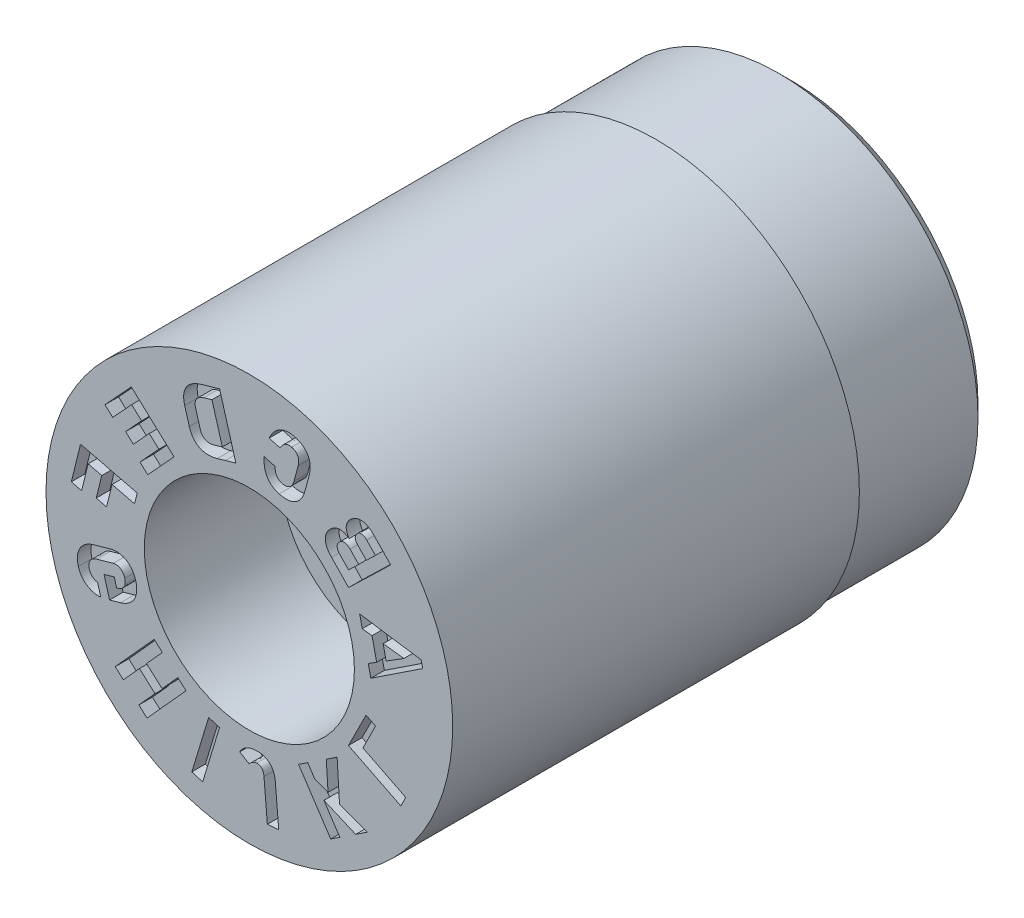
SolidWorks part; units mm, degrees
ref_plane "Front Plane" through (0, 0, 0) normal (0, 0, 1) x (1, 0, 0)
ref_plane "Top Plane" through (0, 0, 0) normal (0, 1, 0) x (1, 0, 0)
ref_plane "Right Plane" through (0, 0, 0) normal (1, 0, 0) x (0, 0, -1)
sketch "Sketch1" plane through (0, 0, 0) normal (1, 0, 0) x (0, 0, -1)
  line L2 (0, 3) -> (0, 1.55)
  line L3 (7.75, 3) -> (0, 3)
  line L4 (-3.7979, 0) -> (49996.2021, 0) construction
  line L8 (8, 0.8) -> (2, 0.8)
  line L9 (2, 1.55) -> (2, 0.8)
  line L10 (2, 1.55) -> (0, 1.55)
  line L12 (8, 0.8) -> (8, 2.75)
  line L16 (8, 2.75) -> (7.75, 3)
  dimension "D1" = 8
  dimension "D2" = 45
  dimension "D3" = 0.25
  dimension "D4" = 6
  dimension "D5" = 3.1
  dimension "D6" = 2
  dimension "D7" = 1.6
revolve "Revolve1" add sketch "Sketch1" angle 360 about L4
sketch "Sketch4" plane through (0, 0, 0) normal (1, 0, 0) x (0, 0, -1)
  line L0 (0, 0) -> (50000, 0) construction
  line L1 (8, -2.75) -> (8, 2.75) construction
  line L2 (6, 3.935) -> (8, 3.935)
  line L3 (6, 3.935) -> (6, 2.935)
  line L4 (6, 2.935) -> (8, 2.935)
  line L5 (8, 3.935) -> (8, 2.935)
  line L6 (7.75, 3) -> (0, 3) construction
  line L9 (0, 55) -> (0, -55) construction
  dimension "D1" = 1
  dimension "D2" = 0.065
  dimension "D3" = 6
revolve "Cut-Revolve1" cut sketch "Sketch4" angle 360 about L0
sketch "Sketch6" plane through (0, 0, 0) normal (0, 0, 1) x (1, 0, 0)
  line L0 (2.5571, 0.5171) -> (2.5349, 0.6172)
  line L1 (2.5349, 0.6172) -> (1.6277, 0.7509)
  line L2 (1.6277, 0.7509) -> (1.6655, 0.5813)
  line L3 (1.6655, 0.5813) -> (1.8101, 0.5641)
  line L4 (2.2808, 0.5082) -> (2.018, 0.3449)
  line L5 (1.7544, 0.1812) -> (1.7922, 0.0116)
  line L6 (1.7922, 0.0116) -> (2.5571, 0.5171)
  line L7 (2.018, 0.3449) -> (1.9736, 0.5447)
  line L8 (1.9736, 0.5447) -> (2.2808, 0.5082)
  line L9 (1.8101, 0.5641) -> (1.8781, 0.258)
  line L10 (1.6135, 1.3764) -> (1.4641, 1.2319)
  line L11 (1.4641, 1.2319) -> (1.336, 1.3642)
  line L12 (1.3285, 1.5197) -> (1.3298, 1.521)
  line L13 (1.4854, 1.5087) -> (1.6135, 1.3764)
  line L14 (-1.4763, 1.5045) -> (-1.335, 1.3745)
  line L15 (1.7261, 1.4853) -> (1.598, 1.6176)
  line L16 (1.7313, 1.7465) -> (1.8594, 1.6142)
  line L17 (2.0851, 1.6061) -> (1.8404, 1.8591)
  line L18 (-2.0255, 0.579) -> (-1.6938, 0.4969)
  line L19 (1.1985, 1.6218) -> (1.1971, 1.6204)
  line L20 (1.2125, 1.2662) -> (1.4644, 1.0058)
  line L21 (-1.3921, -1.7775) -> (-1.6299, -2.0407)
  line L22 (-1.5163, -1.455) -> (-1.2831, -1.1969)
  line L23 (1.8594, 1.6142) -> (1.7261, 1.4853)
  line L24 (1.1609, -1.7625) -> (0.9637, -1.6875)
  line L25 (1.4644, 1.0058) -> (2.0851, 1.6061)
  line L26 (0.8211, 1.9192) -> (0.882, 2.1465)
  line L27 (0.2919, 2.3293) -> (0.4537, 2.2861)
  line L28 (0.7202, 2.1897) -> (0.6593, 1.9624)
  line L29 (0.3806, 2.0127) -> (0.2187, 2.0558)
  line L30 (-0.3989, 1.8704) -> (-0.5202, 1.8352)
  line L31 (-0.7225, 1.9303) -> (-0.7931, 2.1741)
  line L32 (-0.6729, 2.3629) -> (-0.5516, 2.3981)
  line L33 (0.9637, -1.6875) -> (0.8611, -1.5324)
  line L34 (-0.4389, 2.5936) -> (-0.7129, 2.5143)
  line L35 (-0.9535, 2.1228) -> (-0.8856, 1.888)
  line L36 (-0.4726, 1.6859) -> (-0.3553, 1.7199)
  line L37 (-1.8507, 1.8487) -> (-1.7416, 1.9673)
  line L38 (-0.1991, 1.7651) -> (-0.3553, 1.7199)
  line L39 (-0.5516, 2.3981) -> (-0.3989, 1.8704)
  line L41 (-0.1991, 1.7651) -> (-0.4389, 2.5936)
  line L43 (-1.7362, 1.7435) -> (-1.5905, 1.6095)
  line L45 (-1.1114, 1.3878) -> (-1.7416, 1.9673)
  line L46 (-1.335, 1.3745) -> (-1.6141, 1.0709)
  line L47 (-1.6141, 1.0709) -> (-1.4996, 0.9657)
  line L48 (-1.4996, 0.9657) -> (-1.1114, 1.3878)
  line L50 (-1.5905, 1.6095) -> (-1.8257, 1.3537)
  line L51 (-1.8257, 1.3537) -> (-1.7116, 1.2486)
  line L52 (-1.7116, 1.2486) -> (-1.4763, 1.5045)
  line L54 (-1.8507, 1.8487) -> (-2.1299, 1.5452)
  line L55 (-2.1299, 1.5452) -> (-2.0153, 1.44)
  line L56 (-2.0153, 1.44) -> (-1.7362, 1.7435)
  line L59 (-2.378, 0.6662) -> (-2.1774, 0.6165)
  line L60 (-1.6938, 0.4969) -> (-1.6549, 0.6545)
  line L61 (-1.6549, 0.6545) -> (-2.4907, 0.8612)
  line L62 (-2.1774, 0.6165) -> (-2.2585, 0.2881)
  line L63 (-2.2585, 0.2881) -> (-2.1066, 0.2506)
  line L64 (-2.1066, 0.2506) -> (-2.0255, 0.579)
  line L66 (-2.4907, 0.8612) -> (-2.6265, 0.3121)
  line L67 (-2.6265, 0.3121) -> (-2.4748, 0.2745)
  line L68 (-2.4748, 0.2745) -> (-2.378, 0.6662)
  line L70 (-2.0623, -0.916) -> (-1.9005, -0.8702)
  line L71 (-2.0539, -0.2588) -> (-2.2986, -0.3279)
  line L72 (-2.1919, -0.9454) -> (-2.2397, -0.7767)
  line L73 (-2.2528, -0.4898) -> (-2.0081, -0.4206)
  line L74 (-1.944, -0.7077) -> (-1.9577, -0.7116)
  line L75 (-1.9577, -0.7116) -> (-1.9931, -0.5862)
  line L76 (-1.9931, -0.5862) -> (-2.1436, -0.6288)
  line L77 (-2.1436, -0.6288) -> (-2.0623, -0.916)
  line L78 (-1.6299, -2.0407) -> (-1.5098, -2.1492)
  line L79 (-1.5098, -2.1492) -> (-0.9342, -1.512)
  line L80 (-0.9342, -1.512) -> (-1.0543, -1.4036)
  line L81 (-1.0543, -1.4036) -> (-1.2875, -1.6617)
  line L82 (-1.9788, -1.7256) -> (-1.8588, -1.8341)
  line L83 (-1.8588, -1.8341) -> (-1.6209, -1.5708)
  line L84 (-1.2831, -1.1969) -> (-1.4032, -1.0884)
  line L85 (-1.4032, -1.0884) -> (-1.9788, -1.7256)
  line L86 (-1.6209, -1.5708) -> (-1.3921, -1.7775)
  line L88 (-1.2875, -1.6617) -> (-1.5163, -1.455)
  line L90 (-0.4398, -1.7339) -> (-0.6, -1.6854)
  line L91 (-0.6, -1.6854) -> (-0.8487, -2.5053)
  line L92 (-0.8487, -2.5053) -> (-0.6885, -2.5538)
  line L93 (-0.6885, -2.5538) -> (-0.4398, -1.7339)
  line L94 (-0.1417, -1.8962) -> (-0.001, -1.9813)
  line L95 (0.216, -2.0321) -> (0.2656, -2.6181)
  line L96 (0.2656, -2.6181) -> (0.4335, -2.604)
  line L97 (0.4335, -2.604) -> (0.3838, -2.0173)
  line L98 (1.1004, -1.8942) -> (1.5689, -2.0946)
  line L99 (1.5689, -2.0946) -> (1.7389, -1.9821)
  line L100 (1.7389, -1.9821) -> (1.3302, -1.8268)
  line L102 (1.2002, -2.3386) -> (1.3353, -2.2492)
  line L103 (1.3353, -2.2492) -> (1.1004, -1.8942)
  line L104 (0.8611, -1.5324) -> (0.726, -1.6219)
  line L105 (0.726, -1.6219) -> (1.2002, -2.3386)
  line L107 (1.3302, -1.8268) -> (1.295, -1.2455)
  line L108 (1.295, -1.2455) -> (1.1347, -1.3514)
  line L109 (1.1347, -1.3514) -> (1.1609, -1.7625)
  line L110 (2.235, -1.3993) -> (2.308, -1.2537)
  line L111 (2.308, -1.2537) -> (1.6759, -0.9371)
  line L113 (1.4626, -1.0125) -> (2.235, -1.3993)
  line L114 (1.6759, -0.9371) -> (1.862, -0.5653)
  line L115 (1.862, -0.5653) -> (1.7218, -0.4952)
  line L116 (1.7218, -0.4952) -> (1.4626, -1.0125)
  line L118 (1.8781, 0.258) -> (1.7544, 0.1812)
  spline S0 degree 3 poles (1.336, 1.3642) (1.3244, 1.3762) (1.3095, 1.3954) (1.298, 1.4242) (1.2944, 1.4448) (1.2959, 1.4651) (1.3043, 1.4922) (1.3179, 1.5096) (1.3285, 1.5197) knots 0 0 0 0 0.283532 0.406676 0.523065 0.636271 0.749424 1 1 1 1
  spline S1 degree 3 poles (1.3298, 1.521) (1.3372, 1.5279) (1.3487, 1.5377) (1.3663, 1.5459) (1.3792, 1.5502) (1.3924, 1.5525) (1.4059, 1.5522) (1.4194, 1.5503) (1.433, 1.5458) (1.4465, 1.5395) (1.465, 1.5282) (1.4773, 1.5168) (1.4854, 1.5087) knots 0 0 0 0 0.172391 0.251587 0.32731 0.402967 0.477182 0.553868 0.634034 0.717812 0.806398 1 1 1 1
  spline S2 degree 3 poles (1.598, 1.6176) (1.5875, 1.6285) (1.5742, 1.646) (1.564, 1.6723) (1.5614, 1.6914) (1.5633, 1.7102) (1.572, 1.7353) (1.5846, 1.7516) (1.5947, 1.7612) knots 0 0 0 0 0.278253 0.39924 0.514829 0.629035 0.743645 1 1 1 1
  spline S3 degree 3 poles (1.5947, 1.7612) (1.6037, 1.7699) (1.6191, 1.7811) (1.6429, 1.7869) (1.6608, 1.7872) (1.6789, 1.783) (1.7044, 1.7718) (1.7207, 1.7571) (1.7313, 1.7465) knots 0 0 0 0 0.243287 0.354451 0.467149 0.58504 0.709821 1 1 1 1
  spline S4 degree 3 poles (1.8404, 1.8591) (1.8221, 1.8776) (1.794, 1.9033) (1.7521, 1.929) (1.7216, 1.9432) (1.691, 1.9529) (1.6605, 1.9578) (1.6302, 1.9575) (1.6001, 1.9527) (1.5707, 1.943) (1.5313, 1.9236) (1.5049, 1.9025) (1.4885, 1.8865) knots 0 0 0 0 0.194856 0.283382 0.366878 0.446237 0.52245 0.597295 0.672599 0.749381 0.828228 1 1 1 1
  spline S5 degree 3 poles (1.4885, 1.8865) (1.4768, 1.8756) (1.4618, 1.8574) (1.446, 1.8308) (1.4376, 1.8103) (1.4319, 1.7893) (1.4291, 1.7679) (1.4291, 1.746) (1.4318, 1.7238) (1.4377, 1.7014) (1.4494, 1.6708) (1.462, 1.6489) (1.4716, 1.6348) knots 0 0 0 0 0.172429 0.253446 0.3329 0.410642 0.487984 0.565627 0.646116 0.728967 0.815207 1 1 1 1
  spline S6 degree 3 poles (1.4716, 1.6348) (1.4574, 1.6459) (1.435, 1.6607) (1.4028, 1.6743) (1.379, 1.6812) (1.3552, 1.6848) (1.3315, 1.6853) (1.308, 1.6826) (1.2849, 1.6766) (1.2622, 1.6677) (1.232, 1.651) (1.2115, 1.6342) (1.1985, 1.6218) knots 0 0 0 0 0.180056 0.264447 0.345697 0.425066 0.50274 0.58012 0.65862 0.738835 0.821735 1 1 1 1
  spline S7 degree 3 poles (1.1971, 1.6204) (1.1804, 1.6045) (1.1584, 1.5784) (1.1373, 1.5395) (1.1266, 1.5101) (1.1209, 1.4801) (1.1196, 1.4496) (1.1234, 1.4188) (1.132, 1.3878) (1.1453, 1.3567) (1.1702, 1.3143) (1.1943, 1.2849) (1.2125, 1.2662) knots 0 0 0 0 0.172259 0.251868 0.328671 0.404017 0.478443 0.555079 0.634373 0.717906 0.8057 1 1 1 1
  spline S8 degree 3 poles (0.4389, 1.6905) (0.4542, 1.6866) (0.4768, 1.6814) (0.507, 1.6773) (0.5287, 1.6758) (0.5499, 1.6755) (0.5706, 1.6768) (0.5907, 1.6791) (0.6102, 1.6831) (0.6291, 1.6884) (0.6472, 1.695) (0.6648, 1.7027) (0.6816, 1.7118) (0.6975, 1.7224) (0.7129, 1.7341) (0.7274, 1.7471) (0.7414, 1.7614) (0.7543, 1.777) (0.7667, 1.7936) (0.7778, 1.8118) (0.7882, 1.8309) (0.7979, 1.8512) (0.8098, 1.8804) (0.817, 1.9034) (0.8211, 1.9192) knots 0 0 0 0 0.093041 0.137574 0.180288 0.221966 0.262948 0.302743 0.341969 0.380633 0.418693 0.456346 0.494092 0.531697 0.569549 0.608177 0.647455 0.687506 0.728242 0.770136 0.813404 0.857487 0.903244 1 1 1 1
  spline S9 degree 3 poles (0.882, 2.1465) (0.8861, 2.1623) (0.8915, 2.1857) (0.8956, 2.217) (0.8977, 2.2393) (0.8981, 2.2611) (0.8974, 2.2824) (0.8952, 2.303) (0.8916, 2.323) (0.8869, 2.3423) (0.8806, 2.3609) (0.8734, 2.3788) (0.8645, 2.3957) (0.8546, 2.4121) (0.8434, 2.4276) (0.8308, 2.4424) (0.8171, 2.4564) (0.8021, 2.4694) (0.786, 2.4818) (0.7687, 2.4932) (0.7503, 2.5036) (0.7306, 2.5131) (0.7024, 2.5246) (0.6803, 2.5318) (0.6651, 2.5358) knots 0 0 0 0 0.096646 0.142265 0.186537 0.229586 0.27125 0.312358 0.352139 0.391536 0.43001 0.468003 0.505818 0.54329 0.581231 0.619098 0.657881 0.697033 0.73716 0.777713 0.81958 0.862597 0.90693 1 1 1 1
  spline S10 degree 3 poles (0.6651, 2.5358) (0.6403, 2.5424) (0.6026, 2.5485) (0.5524, 2.5466) (0.5166, 2.5402) (0.4819, 2.5297) (0.4489, 2.514) (0.4174, 2.4941) (0.3879, 2.4694) (0.3601, 2.4407) (0.3255, 2.3951) (0.3041, 2.3567) (0.2919, 2.3293) knots 0 0 0 0 0.164609 0.2424 0.319897 0.396879 0.473938 0.552867 0.634604 0.719746 0.807993 1 1 1 1
  spline S11 degree 3 poles (0.4537, 2.2861) (0.4599, 2.2983) (0.4706, 2.3154) (0.4871, 2.3357) (0.5002, 2.3485) (0.5139, 2.3596) (0.5282, 2.3688) (0.5431, 2.3757) (0.5584, 2.3809) (0.5742, 2.384) (0.5961, 2.3854) (0.6125, 2.3825) (0.6233, 2.3799) knots 0 0 0 0 0.194869 0.28509 0.372239 0.45516 0.535867 0.61291 0.689489 0.76552 0.841164 1 1 1 1
  spline S12 degree 3 poles (0.6233, 2.3799) (0.637, 2.3763) (0.6564, 2.3689) (0.679, 2.3546) (0.6933, 2.3423) (0.7052, 2.3283) (0.7149, 2.3127) (0.7219, 2.2954) (0.7266, 2.2767) (0.7289, 2.2565) (0.7282, 2.2271) (0.7245, 2.2047) (0.7202, 2.1897) knots 0 0 0 0 0.174354 0.254683 0.331248 0.40648 0.4812 0.556972 0.636726 0.719434 0.807138 1 1 1 1
  spline S13 degree 3 poles (0.6593, 1.9624) (0.6555, 1.9473) (0.6475, 1.926) (0.6335, 1.9003) (0.6216, 1.8841) (0.6082, 1.8703) (0.5934, 1.8591) (0.5773, 1.8503) (0.56, 1.8441) (0.5416, 1.8406) (0.5148, 1.8398) (0.4943, 1.843) (0.4807, 1.8467) knots 0 0 0 0 0.193001 0.280018 0.363208 0.441814 0.518168 0.593026 0.66813 0.744727 0.825194 1 1 1 1
  spline S14 degree 3 poles (0.4807, 1.8467) (0.4698, 1.8496) (0.454, 1.8557) (0.4353, 1.8676) (0.4229, 1.878) (0.412, 1.89) (0.4025, 1.9034) (0.3947, 1.9184) (0.3884, 1.9348) (0.3839, 1.9526) (0.3796, 1.9786) (0.3797, 1.9989) (0.3806, 2.0127) knots 0 0 0 0 0.159979 0.236987 0.31261 0.389007 0.465623 0.544809 0.627756 0.713749 0.80432 1 1 1 1
  spline S15 degree 3 poles (0.2187, 2.0558) (0.2164, 2.026) (0.2152, 1.982) (0.2231, 1.9253) (0.2325, 1.8864) (0.2458, 1.8505) (0.2629, 1.8174) (0.2837, 1.7875) (0.3081, 1.7607) (0.3361, 1.7376) (0.3783, 1.7106) (0.4142, 1.6972) (0.4389, 1.6905) knots 0 0 0 0 0.191703 0.280772 0.365726 0.447317 0.525894 0.603227 0.68015 0.75723 0.835508 1 1 1 1
  spline S16 degree 3 poles (-0.5202, 1.8352) (-0.5323, 1.8314) (-0.5504, 1.8277) (-0.5743, 1.825) (-0.5909, 1.8244) (-0.6068, 1.8256) (-0.622, 1.828) (-0.6364, 1.832) (-0.6501, 1.8375) (-0.6628, 1.8444) (-0.6746, 1.8527) (-0.6852, 1.8624) (-0.6949, 1.8733) (-0.7034, 1.8856) (-0.7139, 1.9042) (-0.7192, 1.9197) (-0.7225, 1.9303) knots 0 0 0 0 0.149232 0.218368 0.283345 0.346009 0.406128 0.464759 0.522601 0.579442 0.635448 0.692041 0.748656 0.80738 0.868897 1 1 1 1
  spline S17 degree 3 poles (-0.7931, 2.1741) (-0.7963, 2.1848) (-0.7996, 2.2009) (-0.801, 2.2222) (-0.8003, 2.2373) (-0.7979, 2.2517) (-0.7941, 2.2656) (-0.7887, 2.279) (-0.7814, 2.2916) (-0.7728, 2.3035) (-0.7627, 2.3146) (-0.7514, 2.325) (-0.7385, 2.3344) (-0.7241, 2.3428) (-0.7025, 2.3533) (-0.685, 2.3595) (-0.6729, 2.3629) knots 0 0 0 0 0.131395 0.192752 0.251615 0.30871 0.365291 0.421108 0.478124 0.535945 0.594614 0.654753 0.716891 0.782368 0.850988 1 1 1 1
  spline S18 degree 3 poles (-0.7129, 2.5143) (-0.7296, 2.5095) (-0.7539, 2.5012) (-0.7849, 2.4884) (-0.8064, 2.4781) (-0.8267, 2.467) (-0.8457, 2.455) (-0.8633, 2.4421) (-0.8798, 2.4287) (-0.8949, 2.4143) (-0.9087, 2.3993) (-0.9212, 2.3836) (-0.932, 2.3671) (-0.9416, 2.35) (-0.9499, 2.3323) (-0.9568, 2.3138) (-0.962, 2.2946) (-0.9661, 2.2749) (-0.9688, 2.2546) (-0.9696, 2.2339) (-0.9695, 2.2126) (-0.9677, 2.1908) (-0.9632, 2.1606) (-0.9579, 2.1379) (-0.9535, 2.1228) knots 0 0 0 0 0.099746 0.147049 0.192637 0.23665 0.279574 0.321243 0.362131 0.401789 0.440671 0.479065 0.516588 0.55395 0.591347 0.628908 0.666895 0.705553 0.744368 0.784094 0.824759 0.866461 0.909397 1 1 1 1
  spline S19 degree 3 poles (-0.8856, 1.888) (-0.8812, 1.8736) (-0.8743, 1.8524) (-0.8621, 1.8257) (-0.8524, 1.8069) (-0.8415, 1.7893) (-0.83, 1.7726) (-0.8172, 1.7571) (-0.8037, 1.7425) (-0.7892, 1.7291) (-0.7738, 1.717) (-0.7576, 1.7061) (-0.7404, 1.6965) (-0.7224, 1.6882) (-0.7036, 1.6809) (-0.6837, 1.6754) (-0.6631, 1.6707) (-0.6417, 1.6674) (-0.6196, 1.6656) (-0.5968, 1.6654) (-0.5733, 1.6666) (-0.549, 1.6692) (-0.5151, 1.6746) (-0.4897, 1.6811) (-0.4726, 1.6859) knots 0 0 0 0 0.086654 0.128037 0.168493 0.208142 0.246814 0.285402 0.323356 0.36125 0.398652 0.436107 0.473538 0.511468 0.550104 0.58961 0.629996 0.67143 0.713896 0.7576 0.80273 0.849158 0.897772 1 1 1 1
  spline S20 degree 3 poles (-1.9005, -0.8702) (-1.8855, -0.8661) (-1.8637, -0.8585) (-1.836, -0.8463) (-1.8163, -0.8366) (-1.7979, -0.8255) (-1.7803, -0.8137) (-1.7638, -0.8008) (-1.7484, -0.787) (-1.7341, -0.7724) (-1.7209, -0.7571) (-1.7093, -0.7409) (-1.6985, -0.7243) (-1.6894, -0.7068) (-1.6813, -0.6886) (-1.6748, -0.6697) (-1.6692, -0.6502) (-1.6652, -0.6302) (-1.6624, -0.6098) (-1.6613, -0.5891) (-1.6612, -0.5681) (-1.6629, -0.5467) (-1.6669, -0.5174) (-1.6715, -0.4954) (-1.6759, -0.4809) knots 0 0 0 0 0.091969 0.136358 0.179438 0.222009 0.263573 0.304999 0.345795 0.386082 0.42603 0.465295 0.504143 0.543078 0.582146 0.621762 0.661686 0.70208 0.742402 0.783397 0.824885 0.866985 0.910204 1 1 1 1
  spline S21 degree 3 poles (-1.6759, -0.4809) (-1.68, -0.4662) (-1.6873, -0.4448) (-1.6991, -0.4176) (-1.7087, -0.3983) (-1.7194, -0.38) (-1.7311, -0.3628) (-1.7436, -0.3464) (-1.7571, -0.3313) (-1.7714, -0.3172) (-1.7863, -0.3042) (-1.802, -0.2926) (-1.8183, -0.2821) (-1.8352, -0.2728) (-1.853, -0.265) (-1.8712, -0.2582) (-1.8901, -0.2529) (-1.9095, -0.2488) (-1.9292, -0.2461) (-1.9492, -0.2446) (-1.9696, -0.2448) (-1.9903, -0.2461) (-2.0186, -0.2501) (-2.0399, -0.2547) (-2.0539, -0.2588) knots 0 0 0 0 0.092475 0.136931 0.180392 0.223336 0.26524 0.306969 0.348034 0.388565 0.428737 0.46807 0.506952 0.546207 0.585275 0.624453 0.664381 0.704535 0.744602 0.785269 0.826038 0.868259 0.910984 1 1 1 1
  spline S22 degree 3 poles (-2.2986, -0.3279) (-2.3137, -0.3318) (-2.3352, -0.3398) (-2.3632, -0.3514) (-2.3826, -0.3616) (-2.4013, -0.3723) (-2.4186, -0.3845) (-2.4353, -0.397) (-2.4506, -0.4109) (-2.465, -0.4254) (-2.4778, -0.4409) (-2.4898, -0.4568) (-2.5, -0.4737) (-2.5093, -0.4911) (-2.5173, -0.5092) (-2.5237, -0.5282) (-2.5293, -0.5476) (-2.5334, -0.5676) (-2.5357, -0.588) (-2.5374, -0.6087) (-2.5369, -0.6298) (-2.5357, -0.6512) (-2.5312, -0.6804) (-2.5269, -0.7024) (-2.5224, -0.717) knots 0 0 0 0 0.092066 0.136207 0.179647 0.221922 0.263543 0.304975 0.345811 0.38614 0.425904 0.465079 0.503809 0.542783 0.58189 0.621278 0.661241 0.701676 0.742089 0.783043 0.824689 0.866992 0.910114 1 1 1 1
  spline S23 degree 3 poles (-2.5224, -0.717) (-2.5155, -0.7408) (-2.5022, -0.7754) (-2.4764, -0.8171) (-2.4539, -0.8453) (-2.4287, -0.8707) (-2.4006, -0.8925) (-2.3703, -0.911) (-2.3377, -0.9258) (-2.3031, -0.9369) (-2.2545, -0.9464) (-2.217, -0.9475) (-2.1919, -0.9454) knots 0 0 0 0 0.170424 0.253047 0.335432 0.417443 0.498279 0.578817 0.660913 0.743699 0.827422 1 1 1 1
  spline S24 degree 3 poles (-2.2397, -0.7767) (-2.2491, -0.7764) (-2.263, -0.774) (-2.2807, -0.7679) (-2.2932, -0.7615) (-2.3052, -0.7539) (-2.3161, -0.7448) (-2.3263, -0.7347) (-2.3447, -0.7122) (-2.3553, -0.6898) (-2.3605, -0.6711) knots 0 0 0 0 0.164046 0.245449 0.327135 0.409874 0.491968 0.576004 0.660561 1 1 1 1
  spline S25 degree 3 poles (-2.3605, -0.6711) (-2.3643, -0.658) (-2.3677, -0.6381) (-2.3669, -0.6116) (-2.3636, -0.5928) (-2.3578, -0.5749) (-2.3493, -0.5583) (-2.3387, -0.5426) (-2.3255, -0.5286) (-2.3102, -0.516) (-2.2864, -0.5015) (-2.2666, -0.4937) (-2.2528, -0.4898) knots 0 0 0 0 0.171992 0.253427 0.333378 0.41244 0.490252 0.568528 0.649601 0.732965 0.818542 1 1 1 1
  spline S26 degree 3 poles (-2.0081, -0.4206) (-1.9958, -0.4173) (-1.9772, -0.4139) (-1.9524, -0.415) (-1.9348, -0.4184) (-1.9179, -0.4241) (-1.9023, -0.4325) (-1.8876, -0.4428) (-1.8746, -0.4559) (-1.8628, -0.4709) (-1.8489, -0.494) (-1.8415, -0.5132) (-1.8377, -0.5267) knots 0 0 0 0 0.16911 0.248856 0.327834 0.406025 0.484178 0.56233 0.643716 0.727928 0.814727 1 1 1 1
  spline S27 degree 3 poles (-1.8377, -0.5267) (-1.8343, -0.54) (-1.83, -0.5601) (-1.8311, -0.5868) (-1.8338, -0.6055) (-1.8393, -0.6232) (-1.8473, -0.6398) (-1.8579, -0.6551) (-1.8708, -0.669) (-1.886, -0.6815) (-1.9098, -0.6961) (-1.93, -0.7036) (-1.944, -0.7077) knots 0 0 0 0 0.174817 0.256335 0.335955 0.413415 0.490445 0.567827 0.64756 0.729545 0.81521 1 1 1 1
  spline S28 degree 3 poles (0.0854, -1.7583) (0.0602, -1.7602) (0.0236, -1.7671) (-0.0222, -1.7839) (-0.053, -1.8003) (-0.081, -1.8196) (-0.1131, -1.8498) (-0.1323, -1.8766) (-0.1417, -1.8962) knots 0 0 0 0 0.272313 0.400093 0.525548 0.647708 0.765611 1 1 1 1
  spline S29 degree 3 poles (-0.001, -1.9813) (0.0051, -1.9719) (0.0158, -1.9588) (0.0327, -1.9442) (0.0464, -1.9348) (0.0609, -1.927) (0.081, -1.919) (0.097, -1.9158) (0.1077, -1.915) knots 0 0 0 0 0.255779 0.381631 0.507721 0.632579 0.754863 1 1 1 1
  spline S30 degree 3 poles (0.1077, -1.915) (0.1217, -1.9139) (0.1432, -1.9152) (0.1679, -1.928) (0.1835, -1.9415) (0.1963, -1.9589) (0.21, -1.9887) (0.2143, -2.0143) (0.216, -2.0321) knots 0 0 0 0 0.235651 0.344658 0.457109 0.574857 0.701905 1 1 1 1
  spline S31 degree 3 poles (0.3838, -2.0173) (0.3828, -2.0029) (0.3797, -1.9819) (0.3743, -1.9546) (0.369, -1.9353) (0.3629, -1.917) (0.3558, -1.8996) (0.3479, -1.883) (0.339, -1.8674) (0.3292, -1.8527) (0.3186, -1.839) (0.3069, -1.8265) (0.2947, -1.8149) (0.2814, -1.8043) (0.2673, -1.7948) (0.2525, -1.7862) (0.2314, -1.7762) (0.2029, -1.7664) (0.1523, -1.756) (0.1124, -1.7561) (0.0854, -1.7583) knots 0 0 0 0 0.096056 0.141719 0.186005 0.229035 0.270581 0.311569 0.351426 0.390713 0.429284 0.467041 0.504643 0.542218 0.580014 0.61797 0.656604 0.735862 0.818728 1 1 1 1
extrude "Cut-Extrude1" cut sketch "Sketch6" against normal blind 0.2
